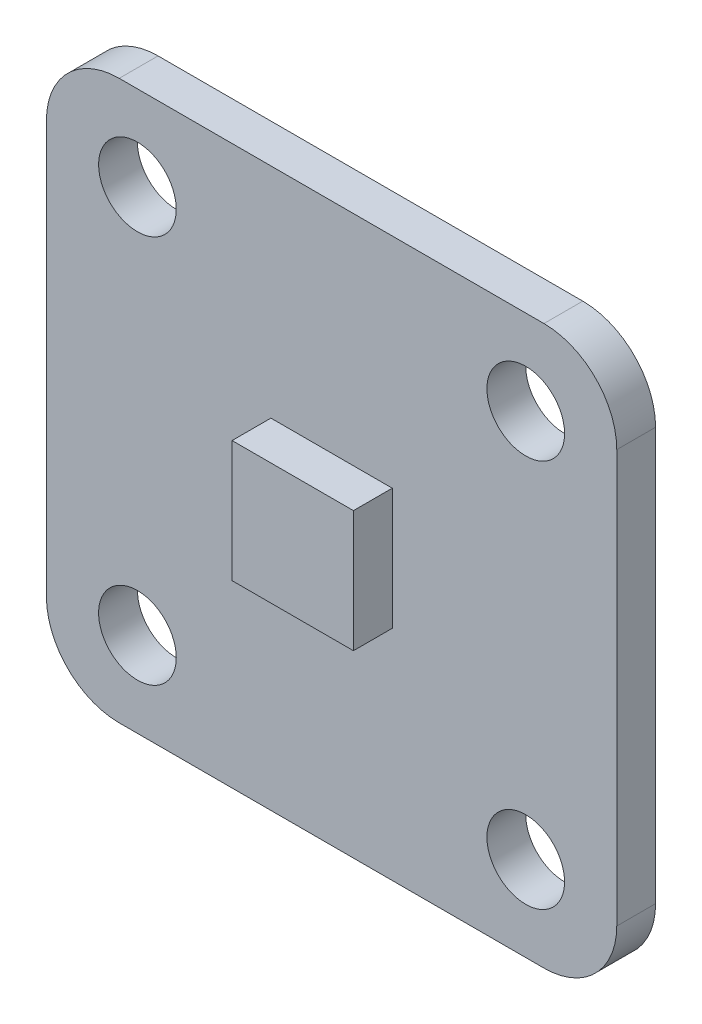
SolidWorks part; units mm, degrees
ref_plane "Přední rovina" through (0, 0, 0) normal (0, 0, 1) x (1, 0, 0)
ref_plane "Horní rovina" through (0, 0, 0) normal (0, 1, 0) x (1, 0, 0)
ref_plane "Pravá rovina" through (0, 0, 0) normal (1, 0, 0) x (0, 0, -1)
sketch "Skica1" plane through (0, 0, 0) normal (0, 0, 1) x (1, 0, 0)
  line L0 (-17.0155, 0) -> (14.1606, 0) construction
  line L1 (-11.75, -11.5) -> (11.75, -11.5)
  line L2 (-11.75, -11.5) -> (-11.75, 11.5)
  line L3 (-11.75, 11.5) -> (11.75, 11.5)
  line L4 (11.75, -11.5) -> (11.75, 11.5)
  line L5 (-11.75, -11.5) -> (11.75, 11.5) construction
  line L6 (-11.75, 11.5) -> (11.75, -11.5) construction
  line L7 (0, 15.1234) -> (0, -13.4973) construction
  circle A0 centre (8, 8) radius 1.6
  circle A1 centre (8, -8) radius 1.6
  circle A2 centre (-8, -8) radius 1.6
  circle A3 centre (-8, 8) radius 1.6
  point P0 (0, 0)
  dimension "D4" = 16
  dimension "D5" = 3.2
  dimension "D1" = 23.5
  dimension "D2" = 23
  dimension "D3" = 16
extrude "Přidat vysunutím1" add sketch "Skica1" along normal blind 1.6
fillet "Zaoblit1" radius 3 4 edges at (-11.75, -11.5, 0.8) (11.75, -11.5, 0.8) (-11.75, 11.5, 0.8) (11.75, 11.5, 0.8)
sketch "Skica2" plane through (0, 0, 1.6) normal (0, 0, 1) x (1, 0, 0)
  line L1 (-2.5, -2.5) -> (2.5, -2.5)
  line L2 (-2.5, -2.5) -> (-2.5, 2.5)
  line L3 (-2.5, 2.5) -> (2.5, 2.5)
  line L4 (2.5, -2.5) -> (2.5, 2.5)
  line L5 (-2.5, -2.5) -> (2.5, 2.5) construction
  line L6 (-2.5, 2.5) -> (2.5, -2.5) construction
  point P0 (0, 0)
  dimension "D1" = 5
extrude "Přidat vysunutím2" add sketch "Skica2" along normal blind 1.6
